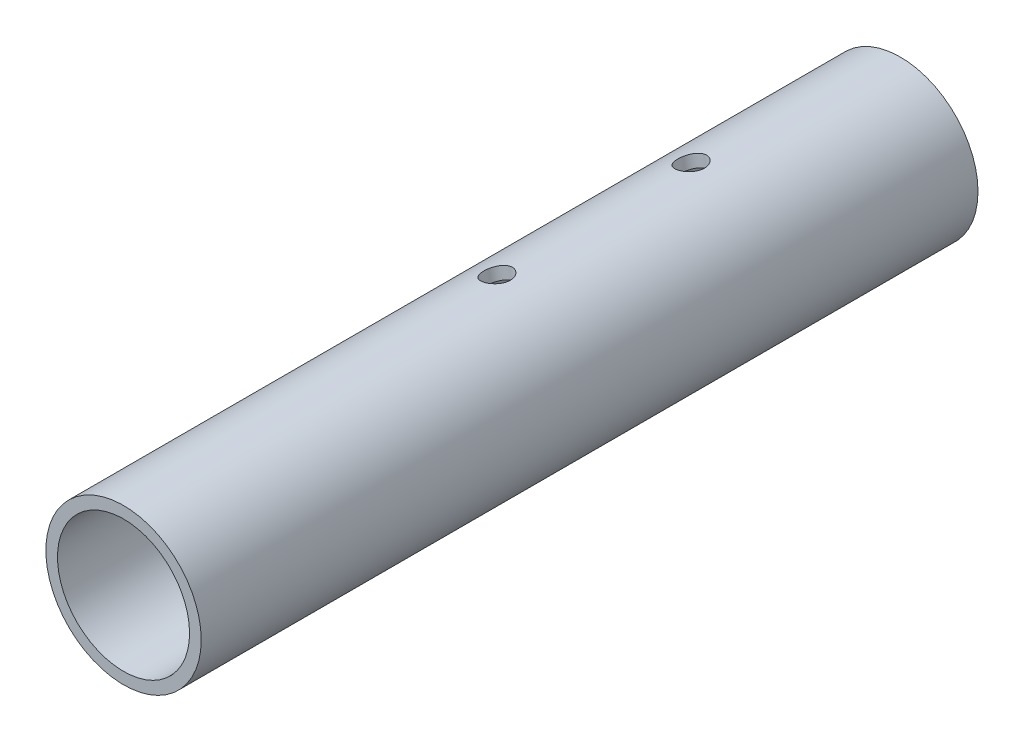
SolidWorks part; units mm, degrees
ref_plane "Plan de face" through (0, 0, 0) normal (0, 0, 1) x (1, 0, 0)
ref_plane "Plan de dessus" through (0, 0, 0) normal (0, 1, 0) x (1, 0, 0)
ref_plane "Plan de droite" through (0, 0, 0) normal (1, 0, 0) x (0, 0, -1)
sketch "Esquisse1" plane through (0, 0, 0) normal (0, 0, 1) x (1, 0, 0)
  circle A0 centre (-10.4242, -1.5385) radius 17
  circle A1 centre (-10.4242, -1.5385) radius 20
  dimension "D1" = 34
  dimension "D2" = 40
extrude "Boss.-Extru.1" add sketch "Esquisse1" along normal blind 200
sketch3d "Esquisse3D1" plane through (0, 0, 0) normal (0, 0, 1) x (1, 0, 0)
sketch "Esquisse2" plane through (3.8028, -19.0983, 0) normal (0.1953, -0.9807, 0) x (0.9807, 0.1953, 0)
  line L0 (-30.5239, 0) -> (9.4761, 0) construction
  circle A0 centre (-10.5239, 100) radius 3.5
  circle A1 centre (-10.5239, 50) radius 3.5
  dimension "D1" = 7
  dimension "D4" = 7
  dimension "D2" = 100
  dimension "D3" = 50
extrude "Enlèv. mat.-Extru.1" cut sketch "Esquisse2" against normal through all
